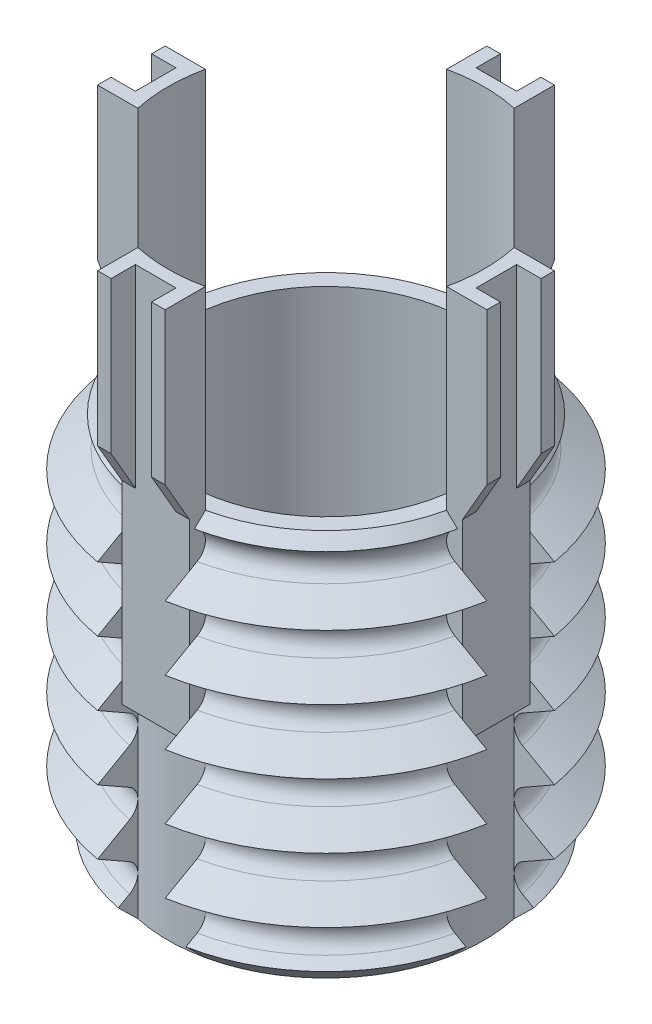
SolidWorks part; units mm, degrees
ref_plane "Front Plane" through (0, 0, 0) normal (0, 0, 1) x (1, 0, 0)
ref_plane "Top Plane" through (0, 0, 0) normal (0, 1, 0) x (1, 0, 0)
ref_plane "Right Plane" through (0, 0, 0) normal (1, 0, 0) x (0, 0, -1)
sketch "Sketch1" plane through (0, 0, 0) normal (0, 1, 0) x (1, 0, 0)
  circle A0 centre (0, 0) radius 5.5565
  circle A1 centre (0, 0) radius 3.969
  dimension "D1" = 7.938
  dimension "D2" = 11.113
extrude "Boss-Extrude1" add sketch "Sketch1" along normal mid plane 10.9
sketch "Sketch2" plane through (0, 5.45, 0) normal (0, 1, 0) x (1, 0, 0)
  circle A0 centre (0, 0) radius 4.445
  dimension "D1" = 8.89
extrude "Cut-Extrude1" cut sketch "Sketch2" against normal through all draft 45 flip side to cut
mirror "Mirror1" about plane through (0, 0, 0) normal (0, 1, 0) of "Cut-Extrude1"
sketch "Sketch3" plane through (0, 5.45, 0) normal (0, 1, 0) x (1, 0, 0)
  line L0 (-5.5565, 0) -> (-5.5565, 0.95)
  line L1 (-5.5565, 0.95) -> (-4.3423, 0.95)
  line L2 (-5.5565, 0) -> (-5.5565, -0.95)
  line L3 (-5.5565, -0.95) -> (-4.3423, -0.95)
  arc A0 (-4.3423, 0.95) -> (-4.3423, -0.95) centre (0, 0) ccw
  circle A1 centre (0, 0) radius 4.445 construction
  circle A2 centre (0, 0) radius 5.5565 construction
  dimension "D1" = 1.9
extrude "Cut-Extrude2" cut sketch "Sketch3" against normal through all
sketch "Sketch4" plane through (0, 0, 0) normal (0, 0, 1) x (1, 0, 0)
  line L1 (5.5565, -4.3385) -> (5.5565, -5.2435)
  line L3 (5.5565, -5.2435) -> (4.673, -4.7334)
  line L6 (4.673, -3.9436) -> (5.5565, -3.4335)
  line L10 (5.5565, -4.3385) -> (5.5565, 4.3385) construction
  line L12 (5.5565, -3.4335) -> (5.5565, -4.3385)
  arc A1 (4.673, -4.7334) -> (4.673, -3.9436) centre (4.901, -4.3385) cw
  point P5 (4.445, -5.45)
  point P9 (4.445, -4.3385)
  dimension "D2" = 60
  dimension "D1" = 1.81
revolve "Cut-Revolve1" cut sketch "Sketch4" angle 360 about axis through (0, 5.45, 0) along (0, -1, 0)
pattern_linear "LPattern1" count 6 spacing 1.81 along (0, 1, 0) of "Cut-Revolve1"
sketch "Sketch5" plane through (0, 5.45, 0) normal (0, -1, 0) x (1, 0, 0)
  line L0 (-4.3423, 0.95) -> (-5.4747, 0.95)
  line L1 (-4.3423, -0.95) -> (-5.4747, -0.95)
  line L2 (-4.7912, -0.57) -> (-5.4747, -0.57)
  line L3 (-4.7912, 0.57) -> (-5.4747, 0.57)
  line L4 (-5.4747, 0.95) -> (-5.4747, 0.57)
  line L5 (-5.4747, -0.57) -> (-5.4747, -0.95)
  line L6 (-4.7912, 0.57) -> (-4.7912, -0.57)
  arc A0 (-4.3423, 0.95) -> (-4.3423, -0.95) centre (0, 0) ccw
  arc A1 (-4.3423, 0.95) -> (-4.3423, -0.95) centre (0, 0) ccw construction
  arc A3 (-4.7912, 0.57) -> (-4.7912, -0.57) centre (0, 0) ccw construction
  dimension "D1" = 0.38
extrude "Boss-Extrude2" add sketch "Sketch5" along normal mid plane 10.9
sketch "Sketch6" plane through (0, 0, 0) normal (0, 0, 1) x (1, 0, 0)
  line L9 (-4.7912, 5.45) -> (-5.4747, 6.6338)
  line L10 (-4.7912, 0) -> (-4.7912, 10.9) construction
  line L11 (-5.4747, 0) -> (-5.4747, 10.9) construction
  line L12 (-5.4747, 6.6338) -> (-5.4747, 0)
  line L13 (-5.4747, 0) -> (-4.7912, 0)
  line L15 (-4.7912, 0) -> (-4.7912, 5.45)
  line L16 (3.969, 5.45) -> (-3.969, 5.45) construction
  dimension "D1" = 150
extrude "Cut-Extrude3" cut sketch "Sketch6" against normal mid plane 1.9
pattern_circular "CirPattern1" count 4 over 360 about axis through (0, 0, 0) along (0, 1, 0) of "Cut-Extrude2", "Boss-Extrude2", "Cut-Extrude3"
